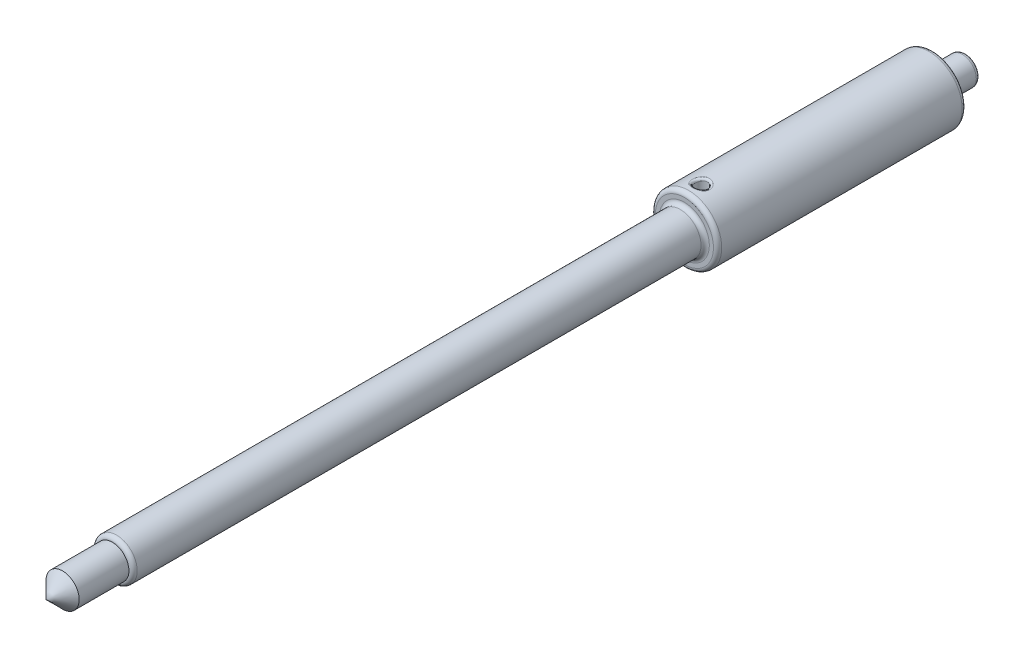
SolidWorks part; units mm, degrees
ref_plane "Спереди" through (0, 0, 0) normal (0, 0, 1) x (1, 0, 0)
ref_plane "Сверху" through (0, 0, 0) normal (0, 1, 0) x (1, 0, 0)
ref_plane "Справа" through (0, 0, 0) normal (1, 0, 0) x (0, 0, -1)
sketch "Эскиз1" plane through (0, 0, 0) normal (1, 0, 0) x (0, 0, -1)
  line L0 (-55.5, 0) -> (55.5, 0)
  line L1 (-55.5, 0) -> (-53.5, 2)
  line L2 (-53.5, 2) -> (-47.5, 2)
  line L3 (-47.5, 2) -> (-47.5, 2.5)
  line L4 (-47.5, 2.5) -> (21.5, 2.5)
  line L5 (21.5, 2.5) -> (21.5, 4)
  line L6 (21.5, 4) -> (51.5, 4)
  line L7 (51.5, 4) -> (51.5, 1.7)
  line L8 (51.5, 1.7) -> (55.5, 1.7)
  line L9 (55.5, 1.7) -> (55.5, 0)
  dimension "D1" = 30
  dimension "D2" = 6
  dimension "D3" = 2
  dimension "D4" = 69
  dimension "D5" = 2
  dimension "D6" = 2.5
  dimension "D7" = 4
  dimension "D8" = 1.7
  dimension "D9" = 4
revolve "Повернуть1" add sketch "Эскиз1" angle 360 about L0
sketch "Эскиз2" plane through (0, 0, 0) normal (0, 1, 0) x (1, 0, 0)
  line L0 (4, 51.5) -> (-4, 51.5) construction
  circle A0 centre (0, 23.5) radius 0.75
  dimension "D1" = 1.5
  dimension "D2" = 28
extrude "Вырез-Вытянуть1" cut sketch "Эскиз2" against normal mid plane 10
fillet "Скругление1" radius 0.25 2 edges at (-0.1578, -3.9969, -24.2332) (0.1578, 3.9969, -24.2332)
fillet "Скругление2" radius 0.5 6 edges at (1.7, 0, -55.5) (1.7, 0, -51.5) (4, 0, -51.5) (4, 0, -21.5) (2.5, 0, -21.5) (2.5, 0, 47.5)
